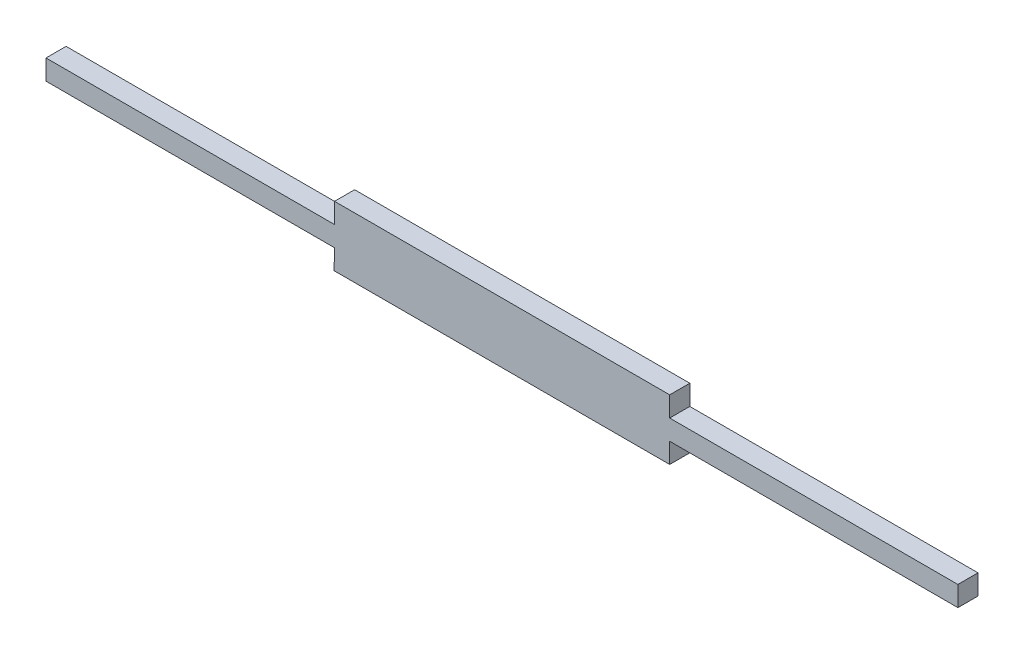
SolidWorks part; units mm, degrees
ref_plane "Front Plane" through (0, 0, 0) normal (0, 0, 1) x (1, 0, 0)
ref_plane "Top Plane" through (0, 0, 0) normal (0, 1, 0) x (1, 0, 0)
ref_plane "Right Plane" through (0, 0, 0) normal (1, 0, 0) x (0, 0, -1)
sketch "Sketch1" plane through (0, 0, 0) normal (0, 0, 1) x (1, 0, 0)
  line L0 (0.2973, 4.1168) -> (22.1608, 4.1168)
  line L2 (0.2973, 4.1168) -> (0.2973, 5.6408)
  line L5 (22.1608, 4.1168) -> (22.1285, 2.5928)
  line L6 (22.1608, 2.5928) -> (0.1011, 2.5928) construction
  line L7 (22.1285, 2.5928) -> (47.5608, 2.5928)
  line L8 (47.5608, 2.5928) -> (47.5608, 4.1168)
  line L9 (47.5608, 4.1168) -> (69.4005, 4.1168)
  line L10 (69.4005, 4.1168) -> (69.4005, 5.6408)
  line L11 (69.4005, 5.6408) -> (47.5608, 5.6408)
  line L12 (47.5608, 5.6408) -> (47.5608, 7.1648)
  line L13 (47.5608, 7.1648) -> (22.1608, 7.1648)
  line L14 (22.1608, 7.1648) -> (22.1608, 5.6408)
  line L15 (22.1608, 5.6408) -> (0.2973, 5.6408)
extrude "Boss-Extrude1" add sketch "Sketch1" along normal blind 1.524
